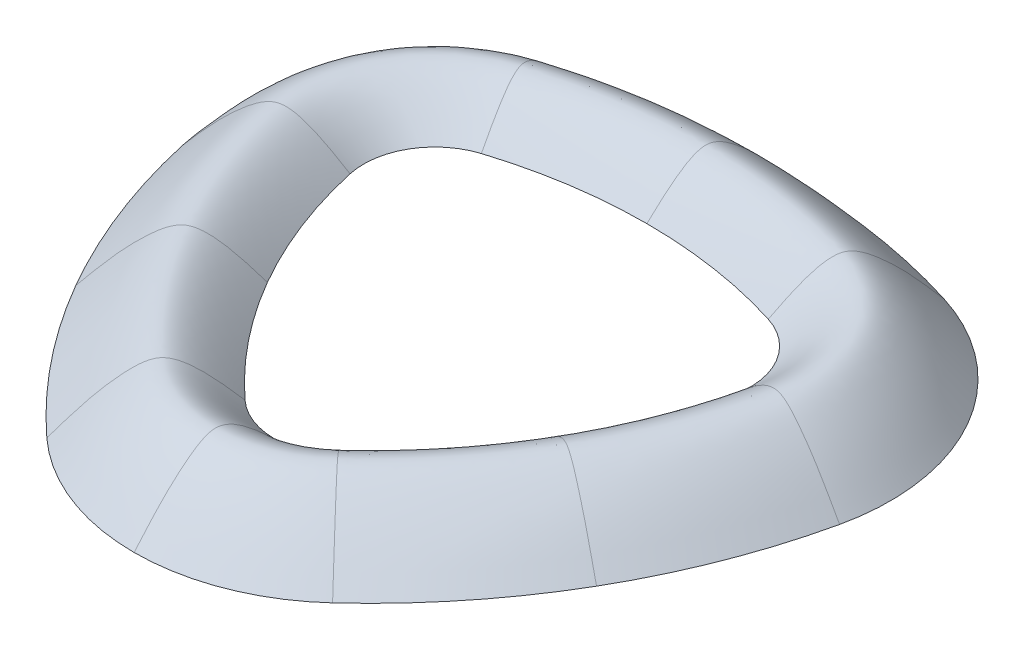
SolidWorks part; units mm, degrees
ref_plane "Plan de face" through (0, 0, 0) normal (0, 0, 1) x (1, 0, 0)
ref_plane "Plan de dessus" through (0, 0, 0) normal (0, 1, 0) x (1, 0, 0)
ref_plane "Plan de droite" through (0, 0, 0) normal (1, 0, 0) x (0, 0, -1)
ref_plane "Plan3" through (0, 110, 0) normal (0, 1, 0) x (-1, 0, 0)
ref_plane "Plan4" through (17.1, 0, 0) normal (1, 0, 0) x (0, 0, -1)
sketch "Esquisse2" plane through (0, 110, 0) normal (0, 1, 0) x (1, 0, 0)
  line L6 (-8.1531, -15.9216) -> (-19.8444, -22.6716)
  line L7 (54.0497, -22.6716) -> (42.3584, -15.9216)
  arc A10 (17.1026, 27.8226) -> (-5.1741, 24.3979) centre (17.1026, -46.3402) ccw
  arc A11 (17.1026, 41.3226) -> (-9.2291, 37.2745) centre (17.1026, -46.3402) ccw
  arc A12 (-9.2291, 37.2745) -> (-29.5045, 2.1565) centre (-0.2179, 8.6598) ccw
  arc A13 (-29.5045, 2.1565) -> (-19.8444, -22.6716) centre (56.0737, 21.1599) ccw
  arc A14 (-16.3255, 5.083) -> (-8.1531, -15.9216) centre (56.0738, 21.1598) ccw
  arc A15 (-5.1741, 24.3979) -> (-16.3255, 5.083) centre (-0.2179, 8.6598) ccw
  arc A16 (-8.1531, -15.9216) -> (5.9512, -33.5014) centre (56.0738, 21.1598) ccw
  arc A17 (-19.8444, -22.6716) -> (-3.1727, -43.4515) centre (56.0738, 21.1598) ccw
  arc A18 (-3.1727, -43.4515) -> (37.378, -43.4515) centre (17.1026, -21.3402) ccw
  arc A19 (37.378, -43.4515) -> (54.0497, -22.6716) centre (-21.8686, 21.1598) ccw
  arc A20 (28.2541, -33.5014) -> (42.3584, -15.9216) centre (-21.8685, 21.1598) ccw
  arc A21 (5.9512, -33.5014) -> (28.2541, -33.5014) centre (17.1026, -21.3402) ccw
  arc A22 (-8.1531, -15.9216) -> (5.9512, -33.5014) centre (56.0738, 21.1598) ccw
  arc A23 (-19.8444, -22.6716) -> (-3.1727, -43.4515) centre (56.0738, 21.1598) ccw
  arc A24 (-3.1727, -43.4515) -> (37.378, -43.4515) centre (17.1026, -21.3402) ccw
  arc A25 (37.378, -43.4515) -> (54.0497, -22.6716) centre (-21.8686, 21.1598) ccw
  arc A26 (28.2541, -33.5014) -> (42.3584, -15.9216) centre (-21.8685, 21.1598) ccw
  arc A27 (5.9512, -33.5014) -> (28.2541, -33.5014) centre (17.1026, -21.3402) ccw
  arc A34 (42.3584, -15.9216) -> (50.5308, 5.083) centre (-21.8685, 21.1598) ccw
  arc A35 (54.0497, -22.6716) -> (63.7098, 2.1564) centre (-21.8685, 21.1599) ccw
  arc A36 (63.7098, 2.1564) -> (43.4344, 37.2745) centre (34.4231, 8.6598) ccw
  arc A37 (43.4344, 37.2745) -> (17.1026, 41.3226) centre (17.1027, -46.3402) ccw
  arc A38 (39.3793, 24.3979) -> (17.1026, 27.8226) centre (17.1026, -46.3402) ccw
  arc A39 (50.5308, 5.083) -> (39.3793, 24.3979) centre (34.4231, 8.6598) ccw
  spline S1 degree 3 number of poles 72 (17.1026, -35.3402) -> (17.1026, -35.3402)
  spline S2 degree 3 number of poles 72 (17.1026, -35.3402) -> (17.1026, -35.3402)
  dimension "D2" = 0
  dimension "D4" = 0
sketch "Esquisse5" plane through (17.1, 0, 0) normal (-1, 0, 0) x (0, 0, 1)
  line L0 (-23.3226, 108) -> (-23.3226, 114) construction
  line L1 (-23.3226, 108) -> (-23.3226, 114)
  line L3 (-27.8226, 110) -> (-41.3226, 110)
  line L4 (-27.8226, 114) -> (-23.3226, 114) construction
  line L5 (-27.8226, 114) -> (-23.3226, 114)
  line L6 (51.3402, 110) -> (43.4515, 110) construction
  line L7 (51.3402, 110) -> (42.3402, 110)
  line L8 (37.8402, 110) -> (37.8402, 114) construction
  line L9 (37.8402, 110) -> (37.8402, 114)
  line L10 (-27.8226, 114) -> (-27.8226, 110)
  line L11 (42.3402, 114) -> (42.3402, 110)
  line L12 (42.3402, 114) -> (37.8402, 114)
  spline S0 degree 3 poles (-54903.5092, 51079.9374) (1466.9212, 138.1037) (314.7075, 473.5475) (-48.8728, 102.3988) (-50.7257, 100.4676) (-56.2112, 94.6088) (-59.7712, 90.6164) (-64.9306, 84.467) (-66.6203, 82.3903) (-69.9324, 78.1769) (-71.5567, 76.0374) (-76.2949, 69.5463) (-79.2784, 65.1194) (-84.8072, 56.0168) (-87.3535, 51.3417) (-90.7454, 44.0864) (-91.8043, 41.6272) (-93.2672, 37.8672) (-93.7345, 36.5996) (-94.6163, 34.0604) (-95.0316, 32.7869) (-96.9739, 26.3991) (-98.1012, 21.224) (-98.8575, 14.6561) (-98.976, 13.3376) (-99.1434, 10.6899) (-99.1897, 9.3604) (-101.9345, -200.5305) (529.2263, -505.3387) (-74247.296, 10639.9451) knots -12.002945 -12.002945 -12.002945 -12.002945 0.0625 0.0625 0.125 0.125 0.25 0.25 0.3125 0.3125 0.375 0.375 0.5 0.5 0.625 0.625 0.6875 0.6875 0.71875 0.71875 0.75 0.75 0.875 0.875 0.90625 0.90625 0.9375 0.9375 5.823478 5.823478 5.823478 5.823478 only from (-41.3226, 110) to (-99.1598, 0) construction
  spline S1 degree 3 poles (-41.3226, 110) (-43.2306, 108.1179) (-45.1255, 106.2242) (-48.8728, 102.3988) (-50.7257, 100.4676) (-56.2112, 94.6088) (-59.7712, 90.6164) (-64.9306, 84.467) (-66.6203, 82.3903) (-69.9324, 78.1769) (-71.5567, 76.0374) (-76.2949, 69.5463) (-79.2784, 65.1194) (-84.8072, 56.0168) (-87.3535, 51.3417) (-90.7454, 44.0864) (-91.8043, 41.6272) (-93.2672, 37.8672) (-93.7345, 36.5996) (-94.6163, 34.0604) (-95.0316, 32.7869) (-96.9739, 26.3991) (-98.1012, 21.224) (-98.8575, 14.6561) (-98.976, 13.3376) (-99.1434, 10.6899) (-99.1897, 9.3604) (-99.2421, 5.3587) (-99.1732, 2.6751) (-99.1598, 0) knots 0 0 0 0 0.0625 0.0625 0.125 0.125 0.25 0.25 0.3125 0.3125 0.375 0.375 0.5 0.5 0.625 0.625 0.6875 0.6875 0.71875 0.71875 0.75 0.75 0.875 0.875 0.90625 0.90625 0.9375 0.9375 1 1 1 1
  spline S2 degree 3 poles (-74498.6912, 8557.5283) (799.587, -513.4988) (-105.4428, -195.3689) (-97.0461, 12.7934) (-96.8063, 15.3415) (-96.0811, 20.4073) (-95.5957, 22.9251) (-94.7005, 26.6811) (-94.3743, 27.9297) (-93.6684, 30.4203) (-93.2885, 31.6628) (-91.2812, 37.8039) (-89.3211, 42.5387) (-84.8745, 51.7438) (-82.3865, 56.2133) (-78.3432, 62.7612) (-76.9432, 64.9175) (-74.7726, 68.1165) (-74.0372, 69.1772) (-72.5486, 71.2806) (-71.795, 72.3243) (-67.9828, 77.5045) (-64.7929, 81.5279) (-58.189, 89.3814) (-54.7744, 93.2111) (-49.5151, 98.8372) (-47.7389, 100.6927) (325.3347, 482.5877) (1557.7633, 120.2822) (-55711.5333, 50189.8675) knots -4.947507 -4.947507 -4.947507 -4.947507 0.0625 0.0625 0.125 0.125 0.1875 0.1875 0.21875 0.21875 0.25 0.25 0.375 0.375 0.5 0.5 0.5625 0.5625 0.59375 0.59375 0.625 0.625 0.75 0.75 0.875 0.875 0.9375 0.9375 13.85816 13.85816 13.85816 13.85816 only from (-97.1833, 2.5) to (-40.5014, 108) construction
  spline S3 degree 3 poles (-97.1833, 2.5) (-97.2144, 5.0814) (-97.253, 7.6638) (-97.0461, 12.7934) (-96.8063, 15.3415) (-96.0811, 20.4073) (-95.5957, 22.9251) (-94.7005, 26.6811) (-94.3743, 27.9297) (-93.6684, 30.4203) (-93.2885, 31.6628) (-91.2812, 37.8039) (-89.3211, 42.5387) (-84.8745, 51.7438) (-82.3865, 56.2133) (-78.3432, 62.7612) (-76.9432, 64.9175) (-74.7726, 68.1165) (-74.0372, 69.1772) (-72.5486, 71.2806) (-71.795, 72.3243) (-67.9828, 77.5045) (-64.7929, 81.5279) (-58.189, 89.3814) (-54.7744, 93.2111) (-49.5151, 98.8372) (-47.7389, 100.6927) (-44.147, 104.3695) (-42.3309, 106.1905) (-40.5014, 108) knots 0 0 0 0 0.0625 0.0625 0.125 0.125 0.1875 0.1875 0.21875 0.21875 0.25 0.25 0.375 0.375 0.5 0.5 0.5625 0.5625 0.59375 0.59375 0.625 0.625 0.75 0.75 0.875 0.875 0.9375 0.9375 1 1 1 1
  spline S4 degree 3 poles (-22537.6569, 3746.396) (23137.337, -5789.8364) (-22726.1069, 7123.5089) (21886.5654, -7097.5824) knots -6.815675 -6.815675 -6.815675 -6.815675 8.191972 8.191972 8.191972 8.191972 only from (81.2122, 68.474) to (51.3402, 110) construction
  spline S5 degree 3 poles (81.2122, 68.474) (71.4487, 84.3158) (60.053, 98.5496) (51.3402, 110) knots 0.568865 0.568865 0.568865 0.568865 1 1 1 1
  spline S6 degree 3 poles (19684.3579, 12060.5778) (115.0555, -173.1198) (138.2853, -24.6122) (77.1646, 71.1542) (76.3878, 72.3575) (75.6044, 73.5564) (74.3649, 75.4317) (72.6518, 77.9713) (70.458, 81.1375) (68.2449, 84.2572) (65.3179, 88.2993) (62.3347, 92.3126) (59.2835, 96.3437) (56.8088, 99.5837) (-232.854, 476.3179) (-439.167, 915.3554) (-18934.1788, -12683.5829) knots -6.945927 -6.945927 -6.945927 -6.945927 0.029562 0.059123 0.088682 0.118246 0.147807 0.227866 0.307928 0.386315 0.464703 0.616942 0.695939 0.777753 0.869386 30.121567 30.121567 30.121567 30.121567 only from (78.6967, 68.7339) to (50.3497, 108) construction
  spline S7 degree 3 poles (78.6967, 68.7339) (78.4429, 69.1383) (77.9352, 69.9469) (77.1646, 71.1542) (76.3878, 72.3575) (75.6044, 73.5564) (74.3649, 75.4317) (72.6518, 77.9713) (70.458, 81.1375) (68.2449, 84.2572) (65.3179, 88.2993) (62.3347, 92.3126) (59.2835, 96.3437) (56.8088, 99.5837) (53.8157, 103.4766) (51.6326, 106.3256) (50.3497, 108) knots 0 0 0 0 0.029562 0.059123 0.088682 0.118246 0.147807 0.227866 0.307928 0.386315 0.464703 0.616942 0.695939 0.777753 0.869386 1 1 1 1
  spline S8 degree 3 poles (51.3402, 110) (47.1474, 115.243) (46.1407, 115.7153) (42.0983, 118.9716) (37.3879, 120.4746) (37.8402, 114) knots 0 0 0 0 0.450652 0.528749 1 1 1 1
  dimension "D1" = 4.5
ref_plane "Plan1" through (17.1, 0, 0) normal (1, 0, 0) x (0, 0, -1)
sketch "Esquisse6" plane through (17.1, 0, 0) normal (1, 0, 0) x (0, 0, -1)
  line L1 (-37.8402, 114) -> (-31.4344, 114.0343)
  line L3 (-37.8402, 114) -> (-37.8402, 110)
  line L4 (-51.3402, 110) -> (-42.3402, 110) construction
  line L5 (-51.3402, 110) -> (-37.8402, 110)
  spline S1 degree 3 poles (-51.3402, 110) (-49.3119, 112.2932) (-46.168, 116.1399) (-41.0032, 119.6289) (-37.5171, 119.3638) (-34.664, 117.098) (-31.4344, 114.0343) knots 0 0 0 0 0.461578 0.652296 0.706138 1 1 1 1
ref_plane "Plan2" through (0, 110, 0) normal (0, 1, 0) x (-1, 0, 0)
sketch "Esquisse7" plane through (0, 110, 0) normal (0, 1, 0) x (-1, 0, 0)
  arc A0 (3.1727, 43.4515) -> (-37.378, 43.4515) centre (-17.1026, 21.3402) ccw construction
  arc A1 (3.1727, 43.4515) -> (-37.378, 43.4515) centre (-17.1026, 21.3402) ccw
  arc A2 (-37.378, 43.4515) -> (-54.0497, 22.6716) centre (21.8686, -21.1598) ccw construction
  arc A3 (-37.378, 43.4515) -> (-54.0497, 22.6716) centre (21.8686, -21.1598) ccw
  arc A4 (-54.0497, 22.6716) -> (-63.7098, -2.1564) centre (21.8685, -21.1599) ccw construction
  arc A5 (-54.0497, 22.6716) -> (-63.7098, -2.1564) centre (21.8685, -21.1599) ccw
  arc A6 (-63.7098, -2.1564) -> (-43.4344, -37.2745) centre (-34.4231, -8.6598) ccw construction
  arc A7 (-63.7098, -2.1564) -> (-43.4344, -37.2745) centre (-34.4231, -8.6598) ccw
  arc A8 (-43.4344, -37.2745) -> (-17.1026, -41.3226) centre (-17.1027, 46.3402) ccw construction
  arc A9 (-43.4344, -37.2745) -> (-17.1026, -41.3226) centre (-17.1027, 46.3402) ccw
  arc A10 (-17.1026, -41.3226) -> (9.2291, -37.2745) centre (-17.1026, 46.3402) ccw construction
  arc A11 (-17.1026, -41.3226) -> (9.2291, -37.2745) centre (-17.1026, 46.3402) ccw
  arc A12 (9.2291, -37.2745) -> (29.5045, -2.1565) centre (0.2179, -8.6598) ccw construction
  arc A13 (9.2291, -37.2745) -> (29.5045, -2.1565) centre (0.2179, -8.6598) ccw
  arc A14 (29.5045, -2.1565) -> (19.8444, 22.6716) centre (-56.0737, -21.1599) ccw construction
  arc A15 (29.5045, -2.1565) -> (19.8444, 22.6716) centre (-56.0737, -21.1599) ccw
  arc A16 (19.8444, 22.6716) -> (3.1727, 43.4515) centre (-56.0738, -21.1598) ccw construction
  arc A17 (19.8444, 22.6716) -> (3.1727, 43.4515) centre (-56.0738, -21.1598) ccw
sweep "Balayage1" add profiles "Esquisse6" path "Esquisse7"
